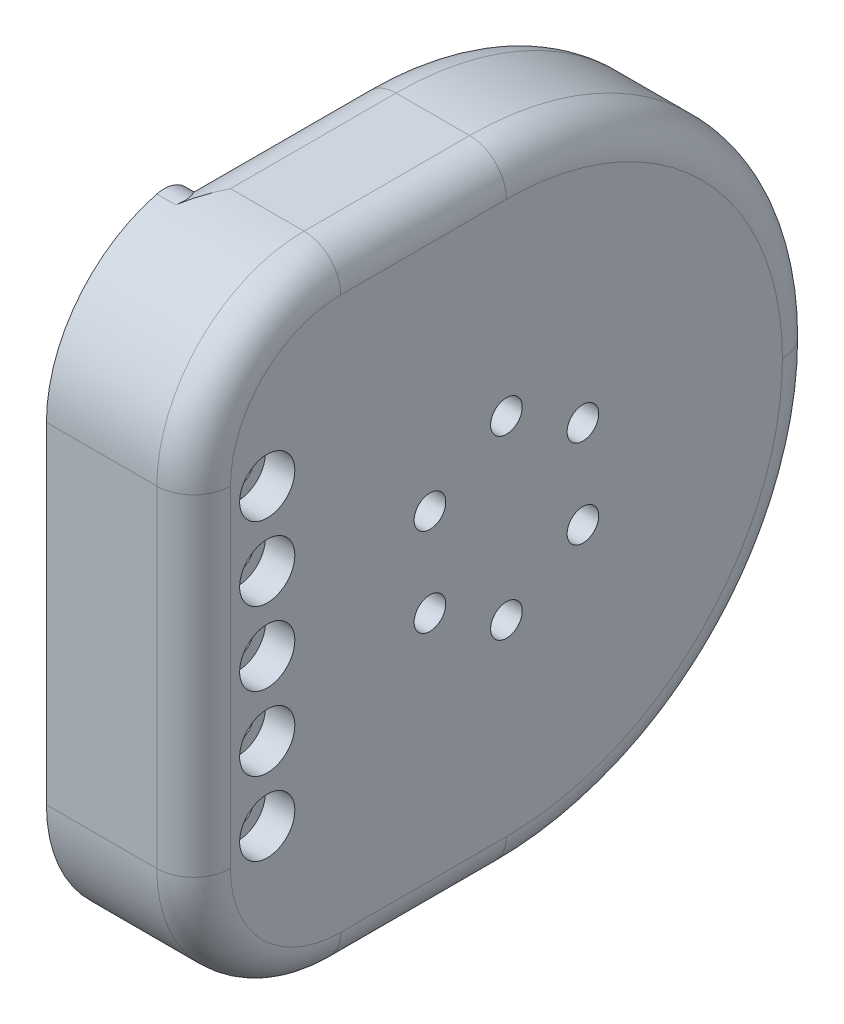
SolidWorks part; units mm, degrees
ref_plane "Front Plane" through (0, 0, 0) normal (0, 0, 1) x (1, 0, 0)
ref_plane "Top Plane" through (0, 0, 0) normal (0, 1, 0) x (1, 0, 0)
ref_plane "Right Plane" through (0, 0, 0) normal (1, 0, 0) x (0, 0, -1)
body saved out of another part "Stock-Hip Adapter-1"
